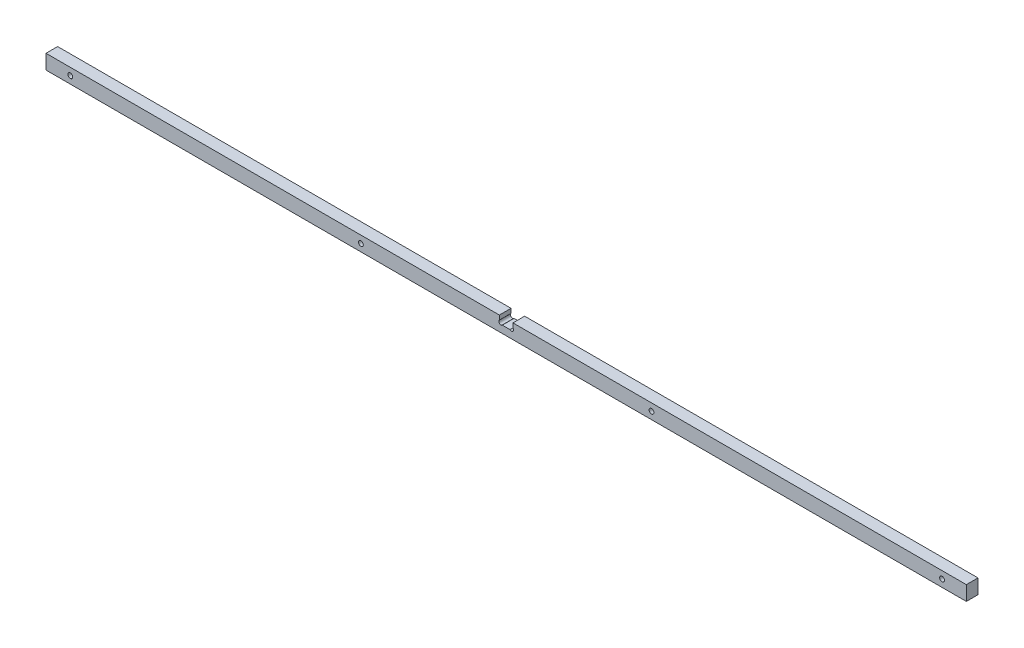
SolidWorks part; units mm, degrees
ref_plane "Спереди" through (0, 0, 0) normal (0, 0, 1) x (1, 0, 0)
ref_plane "Сверху" through (0, 0, 0) normal (0, 1, 0) x (1, 0, 0)
ref_plane "Справа" through (0, 0, 0) normal (1, 0, 0) x (0, 0, -1)
sketch "Эскиз1" plane through (0, 0, 0) normal (0, 0, 1) x (1, 0, 0)
  line L0 (-299.1667, 0) -> (299.1667, 0) construction
  line L1 (-947.5, 15) -> (947.5, 15)
  line L2 (-947.5, 15) -> (-947.5, -15)
  line L3 (-947.5, -15) -> (947.5, -15)
  line L4 (947.5, 15) -> (947.5, -15)
  line L5 (0, -15) -> (0, 15) construction
  line L6 (299.1667, 0) -> (897.5, 0) construction
  line L7 (-299.1667, 0) -> (-897.5, 0) construction
  circle A0 centre (897.5, 0) radius 5
  circle A1 centre (-897.5, 0) radius 5
  circle A3 centre (-299.1667, 0) radius 5
  circle A4 centre (299.1667, 0) radius 5
  dimension "D3" = 10
  dimension "D5" = 50
  dimension "D6" = 598.3333
  dimension "D1" = 30
  dimension "D2" = 1895
  dimension "D4" = 50
extrude "Бобышка-Вытянуть1" add sketch "Эскиз1" along normal blind 24
sketch "Эскиз2" plane through (0, 0, 24) normal (0, 0, 1) x (1, 0, 0)
  line L0 (947.5, 15) -> (-947.5, 15) construction
  line L1 (-14, 15) -> (14, 15)
  line L2 (-14, 15) -> (-14, 6.0104)
  line L3 (-7.9896, 0) -> (7.9896, 0)
  line L4 (14, 15) -> (14, 6.0104)
  line L5 (0, 0) -> (0, 15) construction
  arc A0 (-14, 6.0104) -> (-7.9896, 0) centre (-11, 3) ccw
  arc A1 (7.9896, 0) -> (14, 6.0104) centre (11, 3) ccw
  dimension "D4" = 8.5
  dimension "D1" = 28
  dimension "D2" = 3
  dimension "D3" = 3
extrude "Вырез-Вытянуть1" cut sketch "Эскиз2" against normal through all
